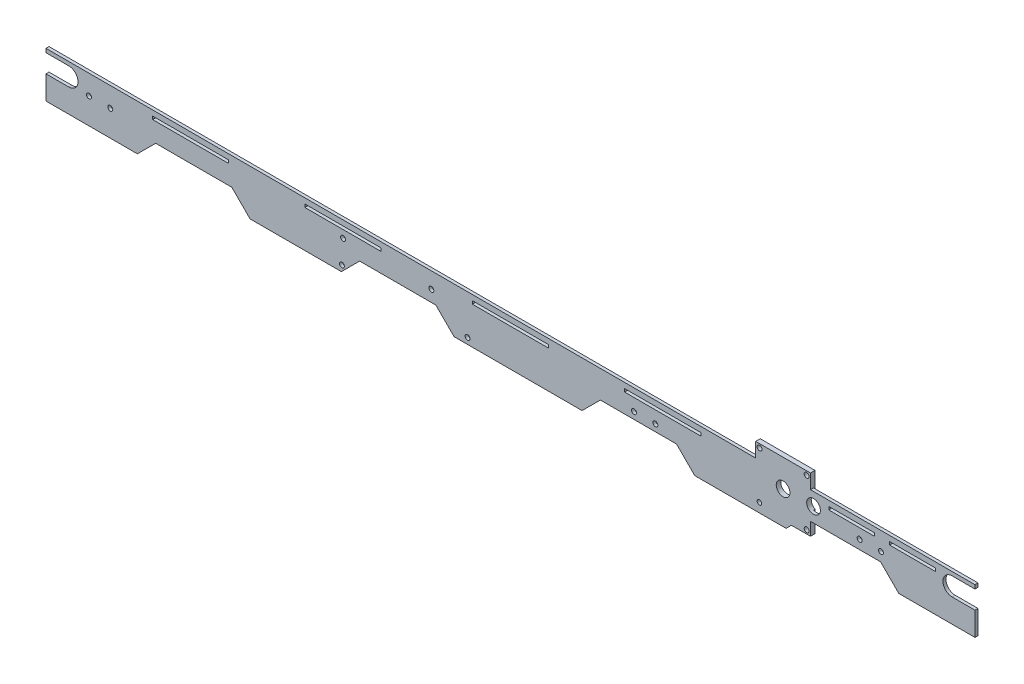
SolidWorks part; units mm, degrees
ref_plane "Front Plane" through (0, 0, 0) normal (0, 0, 1) x (1, 0, 0)
ref_plane "Top Plane" through (0, 0, 0) normal (0, 1, 0) x (1, 0, 0)
ref_plane "Right Plane" through (0, 0, 0) normal (1, 0, 0) x (0, 0, -1)
sketch "Croquis1" plane through (0, 0, 0) normal (0, 0, 1) x (1, 0, 0)
  line L0 (-300, 3) -> (300, 3)
  line L5 (300, 3) -> (300, -27)
  line L6 (300, -27) -> (250, -27)
  line L7 (250, -27) -> (238, -15)
  line L8 (238, -15) -> (188, -15)
  line L9 (188, -15) -> (176, -27)
  line L10 (176, -27) -> (116.02, -27) construction
  line L11 (116.02, -27) -> (104.02, -15)
  line L12 (104.02, -15) -> (54.02, -15)
  line L13 (54.02, -15) -> (42.02, -27)
  line L14 (42.02, -27) -> (-42.02, -27)
  line L15 (0, 0) -> (0, -27) construction
  line L16 (116.02, -27) -> (176, -27)
  line L17 (-176, -27) -> (-116.02, -27) construction
  line L18 (-116.02, -27) -> (-176, -27)
  line L19 (-54.02, -15) -> (-42.02, -27)
  line L20 (-104.02, -15) -> (-54.02, -15)
  line L21 (-116.02, -27) -> (-104.02, -15)
  line L22 (-188, -15) -> (-176, -27)
  line L23 (-238, -15) -> (-188, -15)
  line L24 (-250, -27) -> (-238, -15)
  line L25 (-300, -27) -> (-250, -27)
  line L26 (-300, 3) -> (-300, -27)
  dimension "D1" = 30
  dimension "D2" = 18
  dimension "D3" = 45
  dimension "D4" = 45
  dimension "D5" = 45
  dimension "D6" = 45
  dimension "D7" = 50
  dimension "D8" = 300
  dimension "D9" = 50
  dimension "D10" = 50
  dimension "D11" = 42.02
  dimension "D12" = 59.98
  dimension "D13" = 18
  dimension "D14" = 18
  dimension "D15" = 18
  dimension "D16" = 3
  dimension "D17" = 30
  dimension "D18" = 30
  dimension "D19" = 30
  dimension "D20" = 30
  dimension "D21" = 30
extrude "Saliente-Extruir1" add sketch "Croquis1" along normal blind 2
sketch "Croquis4" plane through (0, 0, 2) normal (0, 0, 1) x (1, 0, 0)
  line L0 (-300, 3) -> (-300, -27) construction
  line L1 (-240, -0.5) -> (-190, -0.5)
  line L2 (-240, -0.5) -> (-240, -2.5)
  line L3 (-240, -2.5) -> (-190, -2.5)
  line L4 (-190, -0.5) -> (-190, -2.5)
  line L5 (-140, -0.5) -> (-90, -0.5)
  line L6 (-140, -0.5) -> (-140, -2.5)
  line L7 (-140, -2.5) -> (-90, -2.5)
  line L8 (-90, -0.5) -> (-90, -2.5)
  line L9 (-30, -0.5) -> (20, -0.5)
  line L10 (-30, -0.5) -> (-30, -2.5)
  line L11 (-30, -2.5) -> (20, -2.5)
  line L12 (20, -0.5) -> (20, -2.5)
  line L13 (70, -0.5) -> (120, -0.5)
  line L14 (70, -0.5) -> (70, -2.5)
  line L15 (70, -2.5) -> (120, -2.5)
  line L16 (120, -0.5) -> (120, -2.5)
  line L17 (120, -1.5) -> (-345.4941, -1.5) construction
  line L18 (300, 3) -> (-300, 3) construction
  dimension "D1" = 2
  dimension "D2" = 60
  dimension "D3" = 50
  dimension "D4" = 50
  dimension "D5" = 50
  dimension "D6" = 50
  dimension "D7" = 50
  dimension "D8" = 50
  dimension "D9" = 60
  dimension "D10" = 3.5
  dimension "D11" = 2
  dimension "D12" = 3.5
  dimension "D13" = 2
  dimension "D14" = 3.5
  dimension "D15" = 2
  dimension "D16" = 3.5
extrude "Cortar-Extruir1" cut sketch "Croquis4" against normal blind 5
sketch "Croquis6" plane through (0, 0, 0) normal (0, 0, -1) x (-1, 0, 0)
  line L0 (-117.3884, -5.5) -> (-221.61, -5.5) construction
  line L2 (-70, -0.5) -> (-120, -0.5) construction
  line L3 (-120, -0.5) -> (-120, -2.5) construction
  circle A0 centre (-174, -5.5) radius 4.5
  dimension "D2" = 9
  dimension "D1" = 5
  dimension "D3" = 54
extrude "Cortar-Extruir3" cut sketch "Croquis6" against normal blind 3
sketch "Croquis7" plane through (0, 0, 2) normal (0, 0, 1) x (1, 0, 0)
  line L0 (158.5, 10) -> (220.5, 10) construction
  line L1 (156, -23.5) -> (192, -23.5)
  line L2 (156, -23.5) -> (156, 12.5)
  line L3 (156, 12.5) -> (192, 12.5)
  line L4 (192, -23.5) -> (192, 12.5)
  line L5 (156, -23.5) -> (192, 12.5) construction
  line L6 (156, 12.5) -> (192, -23.5) construction
  line L7 (192, 20.7798) -> (192, -35.4655) construction
  circle A0 centre (174, -5.5) radius 4.5
  circle A1 centre (174, -5.5) radius 4.5 construction
  circle A2 centre (158.5, 10) radius 1.625
  circle A3 centre (189.5, 10) radius 1.625
  circle A5 centre (189.5, -21) radius 1.625
  circle A7 centre (158.5, -21) radius 1.625
  point P2 (174, -5.5)
  dimension "D1" = 36
  dimension "D3" = 31
  dimension "D4" = 3.25
  dimension "D5" = 3.25
  dimension "D6" = 31
  dimension "D2" = 36
  dimension "D7" = 31
  dimension "D8" = 31
extrude "Saliente-Extruir2" add sketch "Croquis7" against normal blind 3
sketch "Croquis8" plane through (0, 0, 2) normal (0, 0, 1) x (1, 0, 0)
  line L0 (174, -5.5) -> (137.4416, -5.5) construction
  line L3 (231.4504, 47.2218) -> (231.4504, -51.8002) construction
  circle A0 centre (158.5, 10) radius 1.5
  circle A1 centre (174, -5.5) radius 3.6
  circle A2 centre (158.5, -21) radius 1.5
extrude "Cortar-Extruir4" cut sketch "Croquis8" against normal blind 3
sketch "Croquis10" plane through (0, 0, 2) normal (0, 0, 1) x (1, 0, 0)
  line L1 (-300, 3) -> (-310, 3)
  line L2 (-300, 3) -> (-300, -27)
  line L3 (-300, -27) -> (-310, -27)
  line L4 (-310, 3) -> (-310, -27)
  dimension "D1" = 10
  dimension "D2" = 30
extrude "Saliente-Extruir3" add sketch "Croquis10" against normal blind 2
sketch "Croquis20" plane through (0, 0, 0) normal (0, 0, -1) x (-1, 0, 0)
  circle A0 centre (114.9351, -7.5) radius 1.625
  circle A1 centre (56.9351, -7.5) radius 1.625
  dimension "D1" = 3.25
  dimension "D2" = 3.25
extrude "Cortar-Extruir15" cut sketch "Croquis20" against normal blind 10
sketch "Croquis21" plane through (0, 0, 0) normal (0, 0, -1) x (-1, 0, 0)
  line L0 (-90.1377, -10.4995) -> (-76.1377, -10.4995) construction
  circle A0 centre (-76.1377, -10.4995) radius 1.625
  circle A1 centre (-90.1377, -10.4995) radius 1.625
  dimension "D1" = 3.25
  dimension "D2" = 3.25
  dimension "D3" = 14
extrude "Cortar-Extruir16" cut sketch "Croquis21" against normal blind 3
sketch "Croquis22" plane through (0, 0, 2) normal (0, 0, 1) x (1, 0, 0)
  circle A0 centre (224.2734, -9) radius 1.625
  circle A1 centre (238.2734, -9) radius 1.625
  dimension "D1" = 3.25
  dimension "D2" = 3.25
extrude "Cortar-Extruir17" cut sketch "Croquis22" against normal blind 3
sketch "Croquis23" plane through (0, 0, 2) normal (0, 0, 1) x (1, 0, 0)
  line L0 (-281.7723, -10) -> (-267.7723, -10) construction
  line L1 (156, 3) -> (-310, 3) construction
  circle A0 centre (-281.7723, -10) radius 1.625
  circle A1 centre (-267.7723, -10) radius 1.625
  dimension "D1" = 3.25
  dimension "D2" = 3.25
  dimension "D3" = 13
extrude "Cortar-Extruir18" cut sketch "Croquis23" against normal blind 3
sketch "Croquis25" plane through (0, 0, 2) normal (0, 0, 1) x (1, 0, 0)
  line L0 (-295, 0.5) -> (-310, 0.5)
  line L1 (-310, 3) -> (-310, -27) construction
  line L2 (-310, 0.5) -> (-310, -11.5)
  line L3 (-310, -11.5) -> (-295, -11.5)
  line L4 (-190, -0.5) -> (-240, -0.5) construction
  line L5 (-5, 29.772) -> (-5, -143.3003) construction
  line L7 (300, -11.5) -> (285, -11.5)
  line L8 (300, 0.5) -> (300, -11.5)
  line L9 (285, 0.5) -> (300, 0.5)
  arc A0 (-295, -11.5) -> (-295, 0.5) centre (-295, -5.5) ccw
  arc A1 (285, -11.5) -> (285, 0.5) centre (285, -5.5) cw
  point P1 (-289, -5.5)
  point P19 (279, -5.5)
  dimension "D1" = 12
  dimension "D2" = 15
  dimension "D3" = 21
  dimension "D4" = 5
  dimension "D5" = 5
extrude "Cortar-Extruir20" cut sketch "Croquis25" against normal blind 3
sketch "Croquis29" plane through (0, 0, 2) normal (0, 0, 1) x (1, 0, 0)
  circle A0 centre (194, -5.5) radius 4.5
  dimension "D1" = 9
extrude "Cortar-Extruir22" cut sketch "Croquis29" against normal blind 3
sketch "Croquis30" plane through (0, 0, 0) normal (0, 0, -1) x (-1, 0, 0)
  line L0 (-120, -1.5) -> (-324.0699, -1.5) construction
  line L1 (-120, -0.5) -> (-120, -2.5) construction
  line L3 (-274, -0.5) -> (-244, -0.5)
  line L4 (-274, -0.5) -> (-274, -2.5)
  line L5 (-274, -2.5) -> (-244, -2.5)
  line L6 (-244, -0.5) -> (-244, -2.5)
  line L7 (-234, -0.5) -> (-204, -0.5)
  line L8 (-234, -0.5) -> (-234, -2.5)
  line L9 (-234, -2.5) -> (-204, -2.5)
  line L10 (-204, -0.5) -> (-204, -2.5)
  dimension "D1" = 30
  dimension "D2" = 30
  dimension "D3" = 10
  dimension "D4" = 1
  dimension "D5" = 1
  dimension "D6" = 2
  dimension "D7" = 2
  dimension "D8" = 10
extrude "Cortar-Extruir23" cut sketch "Croquis30" against normal blind 3
sketch "Sketch1" plane through (0, 0, 2) normal (0, 0, 1) x (1, 0, 0)
  circle A0 centre (-33.1907, -23) radius 1.6
  circle A1 centre (-115.6502, -23) radius 1.6
  dimension "D1" = 3.2
  dimension "D2" = 3.2
extrude "Cut-Extrude1" cut sketch "Sketch1" against normal blind 5
